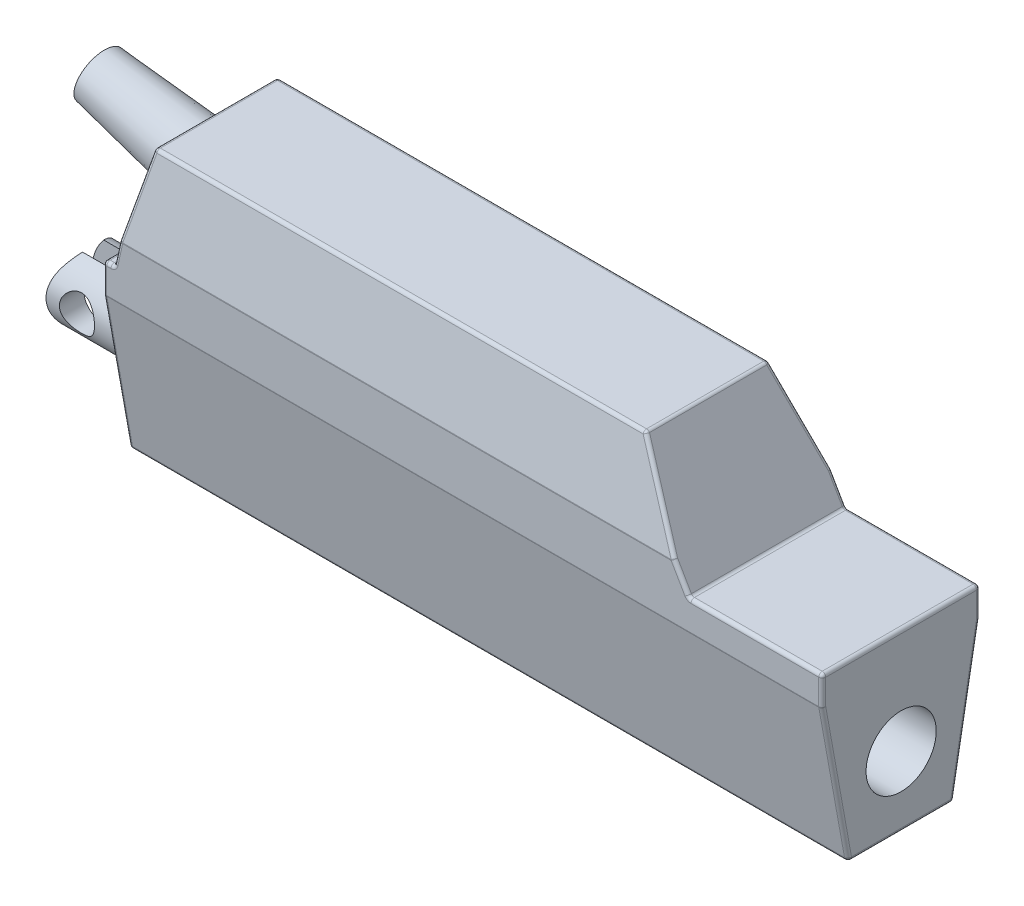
SolidWorks part; units mm, degrees
ref_plane "Face" through (0, 0, 0) normal (0, 0, 1) x (1, 0, 0)
ref_plane "Dessus" through (0, 0, 0) normal (0, 1, 0) x (1, 0, 0)
ref_plane "Droite" through (0, 0, 0) normal (1, 0, 0) x (0, 0, -1)
sketch "Esquisse1" plane through (0, 0, 0) normal (0, 0, 1) x (1, 0, 0)
  line L0 (3, 50) -> (9.6795, 80)
  line L1 (0, 0) -> (205, 0)
  line L2 (0, 0) -> (0, 50)
  line L3 (0, 50) -> (3, 50)
  line L4 (205, 0) -> (205, 50)
  line L5 (9.6795, 80) -> (149.6795, 80)
  line L6 (149.6795, 80) -> (167, 50)
  line L7 (167, 50) -> (205, 50)
  dimension "D1" = 205
  dimension "D2" = 50
  dimension "D3" = 30
  dimension "D4" = 38
  dimension "D5" = 120
  dimension "D6" = 140
  dimension "D7" = 3
extrude "Extrusion1" add sketch "Esquisse1" along normal mid plane 45
sketch "Esquisse2" plane through (0, 0, 0) normal (-1, 0, 0) x (0, 0, 1)
  line L0 (15, 0) -> (24, 50)
  line L1 (22.5, 0) -> (-22.5, 0) construction
  line L2 (-15, 0) -> (-24, 50)
  line L3 (24, 50) -> (17.5, 80)
  line L4 (-24, 50) -> (-17.5, 80)
  line L5 (17.5, 80) -> (-17.5, 80)
  line L6 (15, 0) -> (-15, 0)
  line L8 (22.5, 80) -> (-22.5, 80) construction
  point P8 (0, 80)
  dimension "D1" = 35
  dimension "D2" = 30
  dimension "D3" = 48
extrude "Enlèv. mat.-Extru.2" cut sketch "Esquisse2" against normal blind 245 flip side to cut
sketch "Esquisse3" plane through (0, 0, 0) normal (-1, 0, 0) x (0, 0, 1)
  line L0 (15, 0) -> (-15, 0) construction
  circle A0 centre (0, 20) radius 10
  dimension "D1" = 20
  dimension "D2" = 20
extrude "Extrusion2" add sketch "Esquisse3" along normal blind 25
sketch "Esquisse9" plane through (0, 0, 0) normal (0, 0, 1) x (1, 0, 0)
  line L0 (-25, 30) -> (-25, 10)
  line L1 (-25, 30) -> (-25, 10) construction
  arc A0 (-25, 30) -> (-25, 10) centre (-13.8197, 20) ccw
  dimension "D1" = 15
extrude "Extrusion4" add sketch "Esquisse9" along normal up to surface and the other way up to surface
sketch "Esquisse5" plane through (0, 0, 0) normal (0, 0, 1) x (1, 0, 0)
  line L0 (0, 41.6667) -> (0, 0) construction
  circle A0 centre (-20, 20) radius 5
  dimension "D1" = 10
  dimension "D2" = 20
extrude "Enlèv. mat.-Extru.7" cut sketch "Esquisse5" along normal up to next and the other way up to next
sketch "Esquisse6" plane through (0, 0, 0) normal (-1, 0, 0) x (0, 0, 1)
  line L2 (-3, 29.5394) -> (-3, 10.4606)
  line L4 (3, 29.5394) -> (3, 10.4606)
  arc A0 (3, 29.5394) -> (-3, 29.5394) centre (0, 20) ccw
  arc A1 (-3, 10.4606) -> (3, 10.4606) centre (0, 20) ccw
  circle A2 centre (0, 20) radius 10 construction
  dimension "D1" = 6
extrude "Enlèv. mat.-Extru.8" cut sketch "Esquisse6" along normal blind 170
sketch "Esquisse7" plane through (-7.7484, 1.7252, 0) normal (-0.9761, 0.2173, 0) x (0, 0, 1)
  line L0 (22.5, 48.8049) -> (-22.5, 48.8049) construction
  circle A0 centre (0, 65.8049) radius 7
  dimension "D1" = 14
  dimension "D2" = 17
extrude "Extrusion3" add sketch "Esquisse7" along normal blind 31
draft "Dépouille1" type of draft neutral plane draft angle 4 faces to draft 1 parameters "D1"=4
sketch "Esquisse8" plane through (205, 0, 0) normal (1, 0, 0) x (0, 0, -1)
  line L0 (-15, 0) -> (15, 0) construction
  circle A0 centre (0, 20) radius 10
  dimension "D1" = 20
  dimension "D2" = 20
extrude "Enlèv. mat.-Extru.9" cut sketch "Esquisse8" against normal blind 31
fillet "Congé1" radius 1 36 edges at (1.5, 50, 22.5) (1.5, 50, -22.5) (149.6795, 80, 0) (79.6795, 80, 17.5) (9.6795, 80, 0) (79.6795, 80, -17.5) (0, 0, 0) (0, 20.8333, 18.75) (0, 50, 0) (0, 45.8333, 22.5) (3.7707, 53.4615, 22.5) (7.1105, 68.4615, 20) (83.7722, 56.9231, 22.5) (102.5, 41.6667, 22.5) (102.5, 0, 15) (205, 0, 0) (205, 20.8333, 18.75) (205, 45.8333, 22.5) (186, 50, 22.5) (165.0015, 53.4615, 22.5) (156.3412, 68.4615, 20) (167, 50, 0) (205, 50, 0) (83.7722, 56.9231, -22.5) (102.5, 41.6667, -22.5) (102.5, 0, -15) (0, 20.8333, -18.75) (0, 45.8333, -22.5) (3, 50, 0) (3.7707, 53.4615, -22.5) (7.1105, 68.4615, -20) (156.3412, 68.4615, -20) (165.0015, 53.4615, -22.5) (186, 50, -22.5) (205, 45.8333, -22.5) (205, 20.8333, -18.75)
